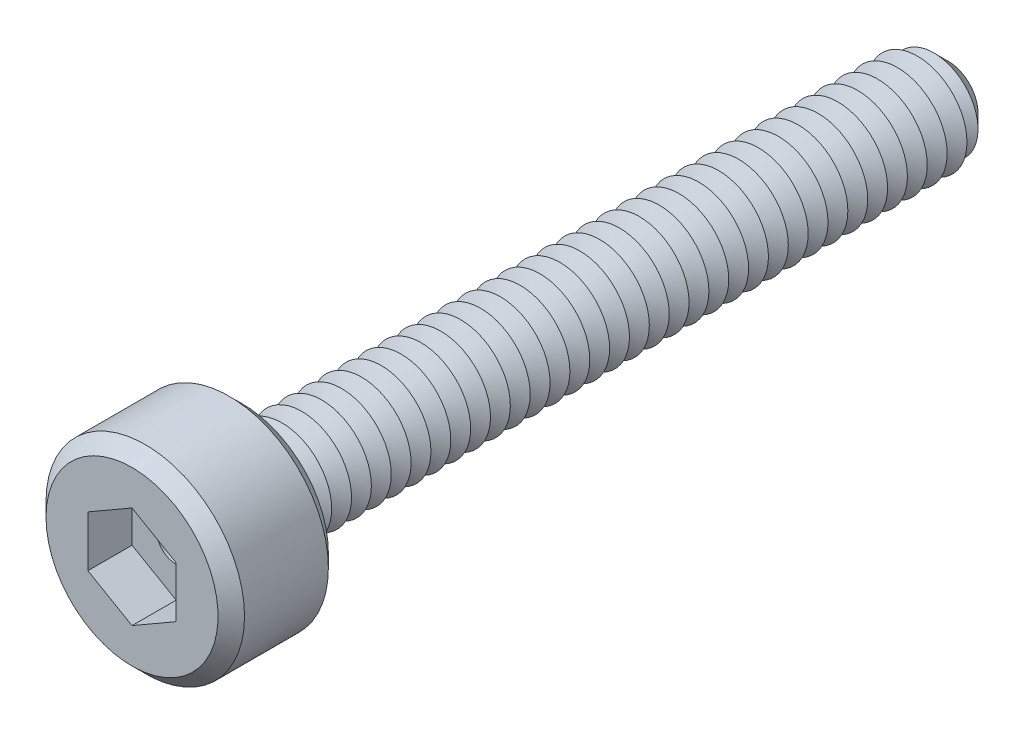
SolidWorks part; units mm, degrees
ref_plane "Front Plane" through (0, 0, 0) normal (0, 0, 1) x (1, 0, 0)
ref_plane "Top Plane" through (0, 0, 0) normal (0, 1, 0) x (1, 0, 0)
ref_plane "Right Plane" through (0, 0, 0) normal (1, 0, 0) x (0, 0, -1)
sketch "Sketch1" plane through (0, 0, 0) normal (0, 0, 1) x (1, 0, 0)
  circle A0 centre (0, 0) radius 2.25
  dimension "D1" = 4.5
extrude "Boss-Extrude1" add sketch "Sketch1" along normal blind 2.5
sketch "Sketch2" plane through (0, 0, 0) normal (0, 0, -1) x (-1, 0, 0)
  circle A0 centre (0, 0) radius 1.125
  dimension "D1" = 2.25
extrude "Boss-Extrude2" add sketch "Sketch2" along normal blind 16
chamfer "Chamfer1" distance 0.45 angle 45 1 edges at (-1.125, 0, -16)
sketch "Sketch3" plane through (0, 0, 0) normal (1, 0, 0) x (0, 0, -1)
  line L0 (-2.5121, 0) -> (4.5776, 0) construction
sketch "Sketch4" plane through (0, 0, 0) normal (1, 0, 0) x (0, 0, -1)
  line L0 (0, 1.125) -> (0.225, 0.7353)
  line L1 (0.225, 0.7353) -> (0.45, 1.125)
  line L2 (15.55, 1.125) -> (0, 1.125) construction
  line L3 (0.45, 1.125) -> (0, 1.125)
  dimension "D1" = 0.45
revolve "Cut-Revolve1" cut sketch "Sketch4" angle 360 about L0
pattern_linear "LPattern1" count 35 spacing 0.45 along (0, 0, -1) of "Cut-Revolve1"
sketch "Sketch5" plane through (0, 0, 2.5) normal (0, 0, 1) x (1, 0, 0)
  line L1 (0, 1.1547) -> (-1, 0.5774)
  line L2 (-1, 0.5774) -> (-1, -0.5774)
  line L3 (-1, -0.5774) -> (0, -1.1547)
  line L4 (0, -1.1547) -> (1, -0.5774)
  line L5 (1, -0.5774) -> (1, 0.5774)
  line L6 (1, 0.5774) -> (0, 1.1547)
  circle A0 centre (0, 0) radius 1 construction
  dimension "D1" = 2
extrude "Cut-Extrude1" cut sketch "Sketch5" against normal blind 1
sketch "Sketch6" plane through (0, 0, 1.5) normal (0, 0, 1) x (1, 0, 0)
  circle A0 centre (0, 0) radius 0.45
  dimension "D1" = 0.9
extrude "Cut-Extrude2" cut sketch "Sketch6" against normal up to surface (17.5 mm away)
chamfer "Chamfer2" distance 0.3 angle 45 2 edges at (2.25, 0, 0) (2.25, 0, 2.5)
